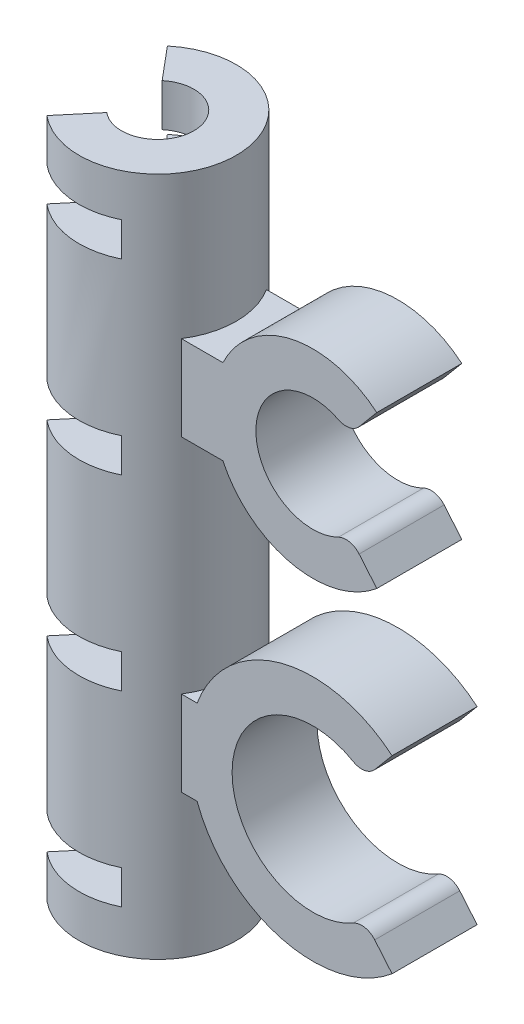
SolidWorks part; units mm, degrees
ref_plane "Front Plane" through (0, 0, 0) normal (0, 0, 1) x (1, 0, 0)
ref_plane "Top Plane" through (0, 0, 0) normal (0, 1, 0) x (1, 0, 0)
ref_plane "Right Plane" through (0, 0, 0) normal (1, 0, 0) x (0, 0, -1)
sketch "Sketch1" plane through (0, 0, 0) normal (0, 1, 0) x (1, 0, 0)
  line L0 (-2.7318, 3.2557) -> (-5.9458, 7.0859)
  line L1 (-5.9458, -7.0859) -> (-2.7318, -3.2557)
  line L2 (0, 7.2069) -> (0, -7.5067) construction
  line L3 (0, -2.2) -> (0, 2.2) construction
  circle A0 centre (0, 0) radius 4.05 construction
  arc A1 (-2.7318, -3.2557) -> (-2.7318, 3.2557) centre (0, 0) ccw
  arc A2 (-5.9458, -7.0859) -> (-5.9458, 7.0859) centre (0, 0) ccw
  point P11 (0, 0)
  dimension "D1" = 8.1
  dimension "D2" = 0.2
  dimension "D3" = 5
  dimension "D4" = 100
  dimension "D5" = 40
extrude "Boss-Extrude1" add sketch "Sketch1" along normal mid plane 80
sketch "Sketch2" plane through (0, 0, 0) normal (0, 0, 1) x (1, 0, 0)
  line L0 (30.7706, 27.0627) -> (27.5567, 23.2325)
  line L1 (30.7706, 9.1373) -> (27.5567, 12.9675)
  line L2 (23.25, 18.1) -> (23.25, -18.1) construction
  line L3 (23.25, -3.6) -> (23.25, 6.4) construction
  line L4 (-5.9458, 0) -> (43.9473, 0) construction
  line L5 (32.5704, -29.2076) -> (29.3565, -25.3774)
  line L6 (32.5704, -6.9924) -> (29.3565, -10.8226)
  line L7 (23.25, -18.1) -> (23.25, -40.5115) construction
  line L8 (-5.9458, 40) -> (-5.9458, -40) construction
  line L9 (10.175, 0) -> (-10.175, 0) construction
  line L10 (4.25, 23.1) -> (12.6722, 23.1)
  line L11 (4.25, 13.1) -> (12.6722, 13.1)
  line L12 (23.25, 18.1) -> (-9.0431, 18.1) construction
  line L13 (4.25, 13.1) -> (4.25, 23.1)
  line L14 (4.25, -13.1) -> (9.6393, -13.1)
  line L15 (4.25, -23.1) -> (9.6393, -23.1)
  line L16 (23.25, -18.1) -> (-12.5685, -18.1) construction
  line L17 (4.25, -13.1) -> (4.25, -23.1)
  line L20 (4.25, 40) -> (4.25, -53.2294) construction
  circle A0 centre (23.25, 18.1) radius 6.5 construction
  arc A1 (27.5567, 23.2325) -> (27.5567, 12.9675) centre (23.25, 18.1) ccw
  arc A2 (30.7706, 27.0627) -> (30.7706, 9.1373) centre (23.25, 18.1) ccw
  arc A4 (29.3565, -10.8226) -> (29.3565, -25.3774) centre (23.25, -18.1) ccw
  arc A5 (32.5704, -6.9924) -> (32.5704, -29.2076) centre (23.25, -18.1) ccw
  point P10 (23.25, 0)
  point P31 (4.25, -18.1)
  point P33 (4.25, 18.1)
  point P36 (0, 0)
  point P37 (0, 0)
  point P38 (8.75, -18.1)
  point P39 (0, 0)
  point P41 (0, 0)
  dimension "D1" = 13
  dimension "D2" = 6.7
  dimension "D3" = 5
  dimension "D6" = 9.5
  dimension "D7" = 5
  dimension "D8" = 10
  dimension "D4" = 100
  dimension "D5" = 40
  dimension "D9" = 10
  dimension "D10" = 100
  dimension "D11" = 40
  dimension "D12" = 4.5
  dimension "D13" = 10
extrude "Boss-Extrude2" add sketch "Sketch2" along normal mid plane 10 contours A2 L10 L13 L11 | L0 A2 L1 A1 | A5 L14 L17 L15 | L6 A5 L5 A4
sketch "Sketch5" plane through (0, 0, 0) normal (0, 0, 1) x (1, 0, 0)
  line L0 (-5.9458, 35) -> (4.0542, 35)
  line L1 (-5.9458, 40) -> (-5.9458, -40) construction
  line L2 (4.0542, 35) -> (4.0542, 31)
  line L3 (4.0542, 31) -> (-5.9458, 31)
  line L4 (9.25, 40) -> (-5.9458, 40) construction
  line L5 (-5.9458, -9) -> (4.0542, -9)
  line L6 (-5.9458, 13) -> (4.0542, 13)
  line L7 (4.0542, 13) -> (4.0542, 9)
  line L8 (4.0542, 9) -> (-5.9458, 9)
  line L9 (4.0542, -9) -> (4.0542, -13)
  line L10 (4.0542, -13) -> (-5.9458, -13)
  line L11 (-5.9458, -31) -> (4.0542, -31)
  line L12 (4.0542, -31) -> (4.0542, -35)
  line L13 (4.0542, -35) -> (-5.9458, -35)
  line L15 (-5.9458, 35) -> (-5.9458, 31)
  line L16 (-5.9458, 13) -> (-5.9458, 9)
  line L17 (-5.9458, -9) -> (-5.9458, -13)
  line L18 (-5.9458, -31) -> (-5.9458, -35)
  dimension "D1" = 5
  dimension "D2" = 10
  dimension "D3" = 4
  dimension "D4" = 18
  dimension "D5" = 18
  dimension "D6" = 18
extrude "Cut-Extrude1" cut sketch "Sketch5" against normal through all both and the other way through all contours L0 L15 L3 L2 | L6 L16 L8 L7 | L5 L17 L10 L9 | L11 L18 L13 L12
fillet "Fillet1" radius 2 4 edges at (27.5567, 12.9675, 0) (27.5567, 23.2325, 0) (29.3565, -25.3774, 0) (29.3565, -10.8226, 0)
